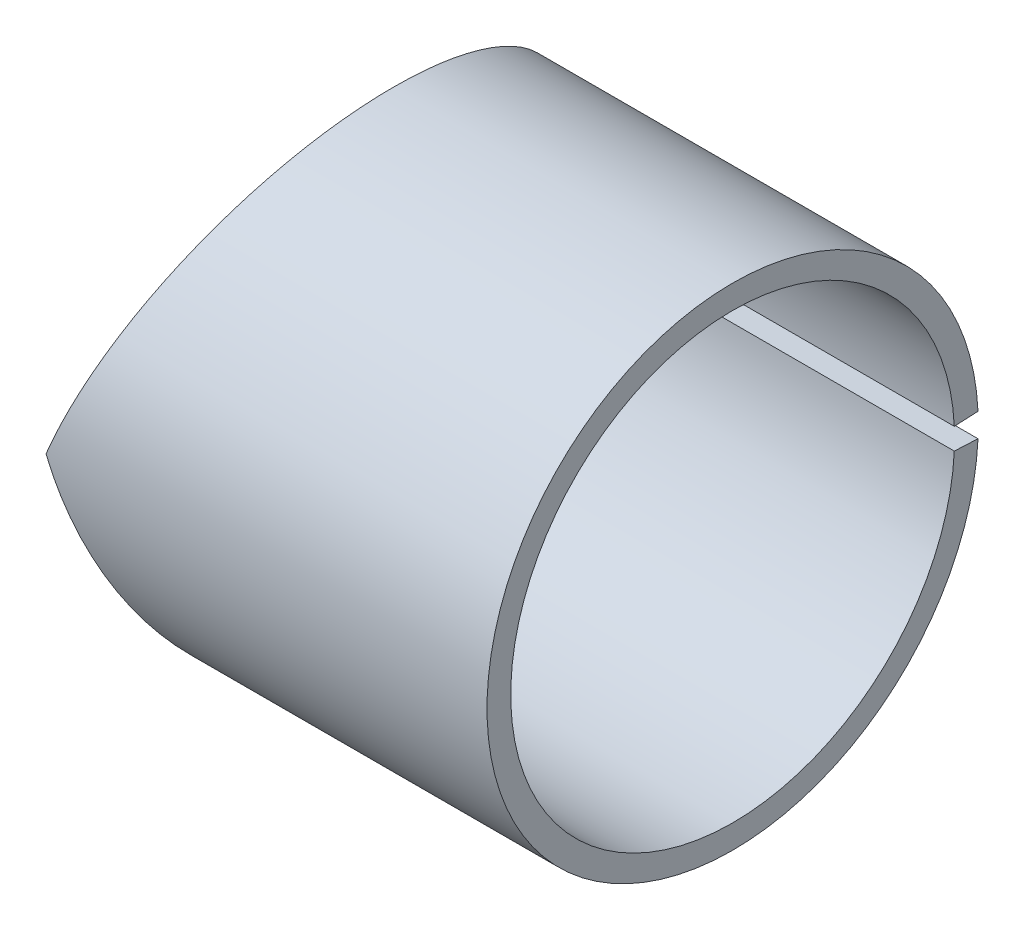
SolidWorks part; units mm, degrees
ref_plane "前视基准面" through (0, 0, 0) normal (0, 0, 1) x (1, 0, 0)
ref_plane "上视基准面" through (0, 0, 0) normal (0, 1, 0) x (1, 0, 0)
ref_plane "右视基准面" through (0, 0, 0) normal (1, 0, 0) x (0, 0, -1)
imported_body "基体零件-带补料的垂直四通管-1"
sheet metal parameters "钣金1" parameters "D1"=0.7366, "厚度"=1
bend "圆角折弯1" bend radius 9.3514 bend angle 354.463 parameters "D5"=1
flatten bends "展开-折弯1"
sketch "尖角-草图1" plane through (27.1237, -0.5, -10.3393) normal (0, -0.0483, -0.9988) x (-1, 0, 0)
  line L0 (9.1883, -28.9263) -> (-9.1883, -28.9263) construction
  dimension "D1" = 0
process bends "加工-折弯1" parameters "D1"=0
sketch "平面-草图1" plane through (27.1237, -0.5, -10.3393) normal (0, -0.0483, -0.9988) x (-1, 0, 0)
